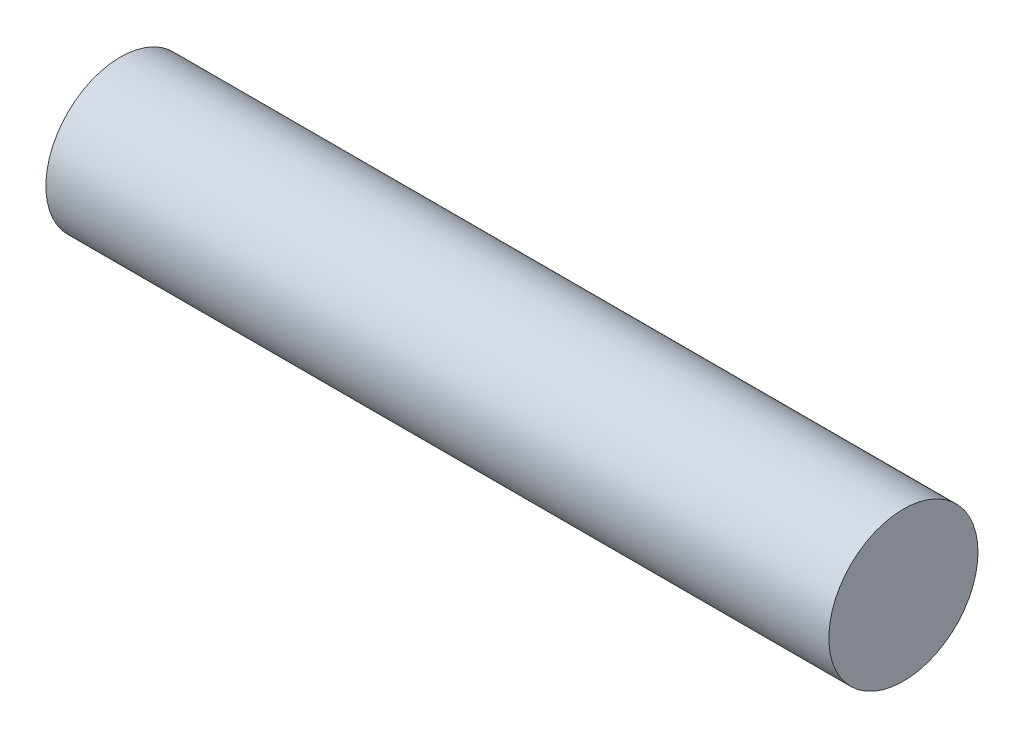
SolidWorks part; units mm, degrees
ref_plane "Front Plane" through (0, 0, 0) normal (0, 0, 1) x (1, 0, 0)
ref_plane "Top Plane" through (0, 0, 0) normal (0, 1, 0) x (1, 0, 0)
ref_plane "Right Plane" through (0, 0, 0) normal (1, 0, 0) x (0, 0, -1)
sketch "Sketch1" plane through (0, 0, 0) normal (1, 0, 0) x (0, 0, -1)
  circle A0 centre (0, 0) radius 4.7625
  dimension "D1" = 9.525
extrude "Boss-Extrude1" add sketch "Sketch1" along normal blind 50
